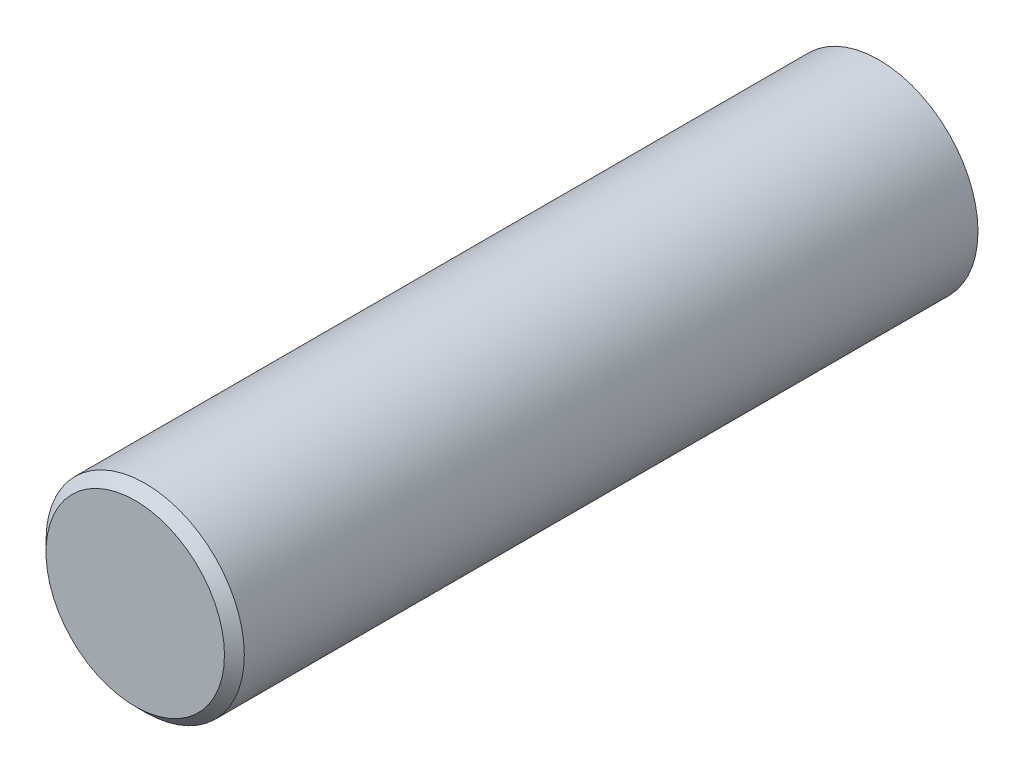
SolidWorks part; units mm, degrees
ref_plane "Plan de face" through (0, 0, 0) normal (0, 0, 1) x (1, 0, 0)
ref_plane "Plan de dessus" through (0, 0, 0) normal (0, 1, 0) x (1, 0, 0)
ref_plane "Plan de droite" through (0, 0, 0) normal (1, 0, 0) x (0, 0, -1)
sketch "Esquisse1" plane through (0, 0, 0) normal (0, 0, 1) x (1, 0, 0)
  circle A0 centre (0, 0) radius 8
  dimension "D1" = 16
extrude "Extrusion1" add sketch "Esquisse1" along normal blind 60
chamfer "Chanfrein1" distance 0.8 angle 45 1 edges at (8, 0, 60)
